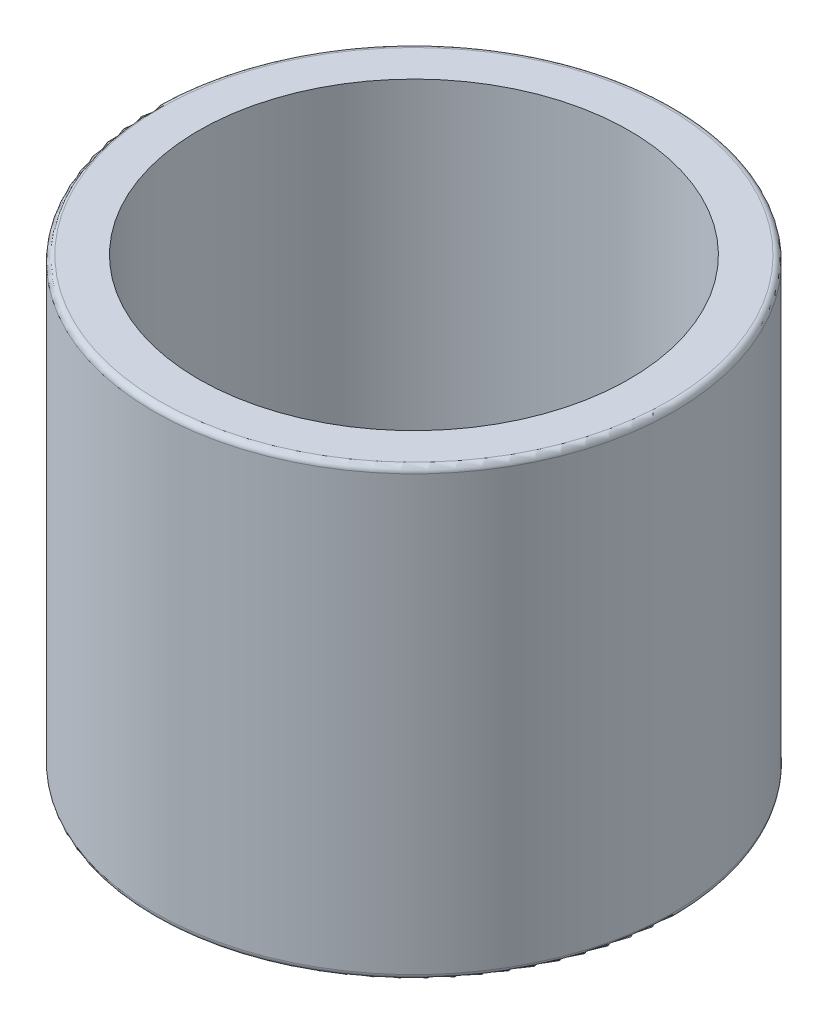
SolidWorks part; units mm, degrees
ref_plane "Front Plane" through (0, 0, 0) normal (0, 0, 1) x (1, 0, 0)
ref_plane "Top Plane" through (0, 0, 0) normal (0, 1, 0) x (1, 0, 0)
ref_plane "Right Plane" through (0, 0, 0) normal (1, 0, 0) x (0, 0, -1)
sketch "Sketch1" plane through (0, 0, 0) normal (0, 1, 0) x (1, 0, 0)
  circle A0 centre (0, 0) radius 17.5
  circle A1 centre (0, 0) radius 14.5
  dimension "D1" = 35
  dimension "D2" = 3
extrude "Boss-Extrude1" add sketch "Sketch1" along normal blind 30
fillet "Fillet1" radius 0.4 2 edges at (0, 0, 17.5) (0, 30, 17.5)
